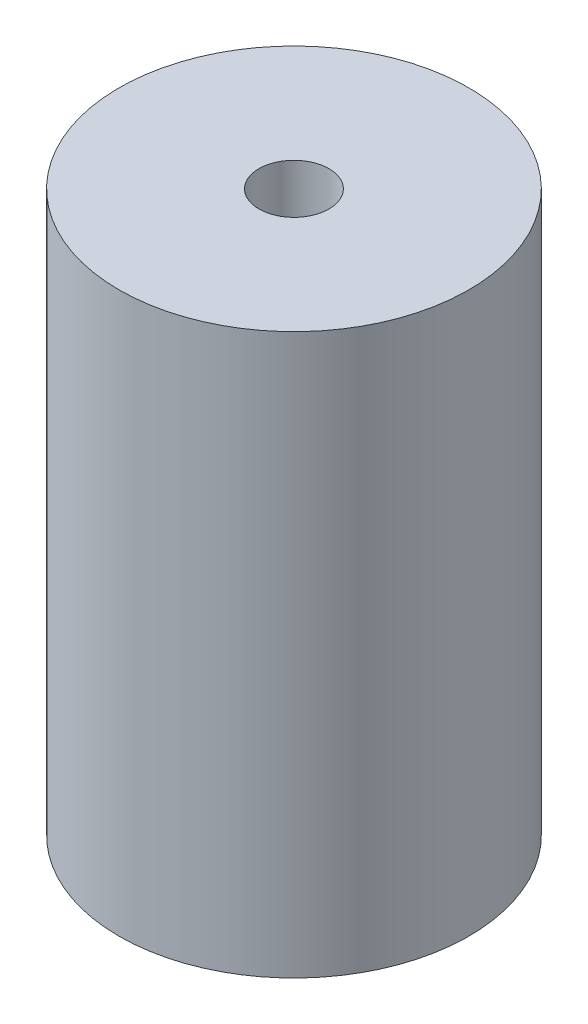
SolidWorks part; units mm, degrees
ref_plane "Front" through (0, 0, 0) normal (0, 0, 1) x (1, 0, 0)
ref_plane "Top" through (0, 0, 0) normal (0, 1, 0) x (1, 0, 0)
ref_plane "Right" through (0, 0, 0) normal (1, 0, 0) x (0, 0, -1)
sketch "Sketch1" plane through (0, 0, 0) normal (0, 1, 0) x (1, 0, 0)
  circle A0 centre (0, 0) radius 1
  circle A1 centre (0, 0) radius 5
extrude "Extrude1" add sketch "Sketch1" along normal blind 16
